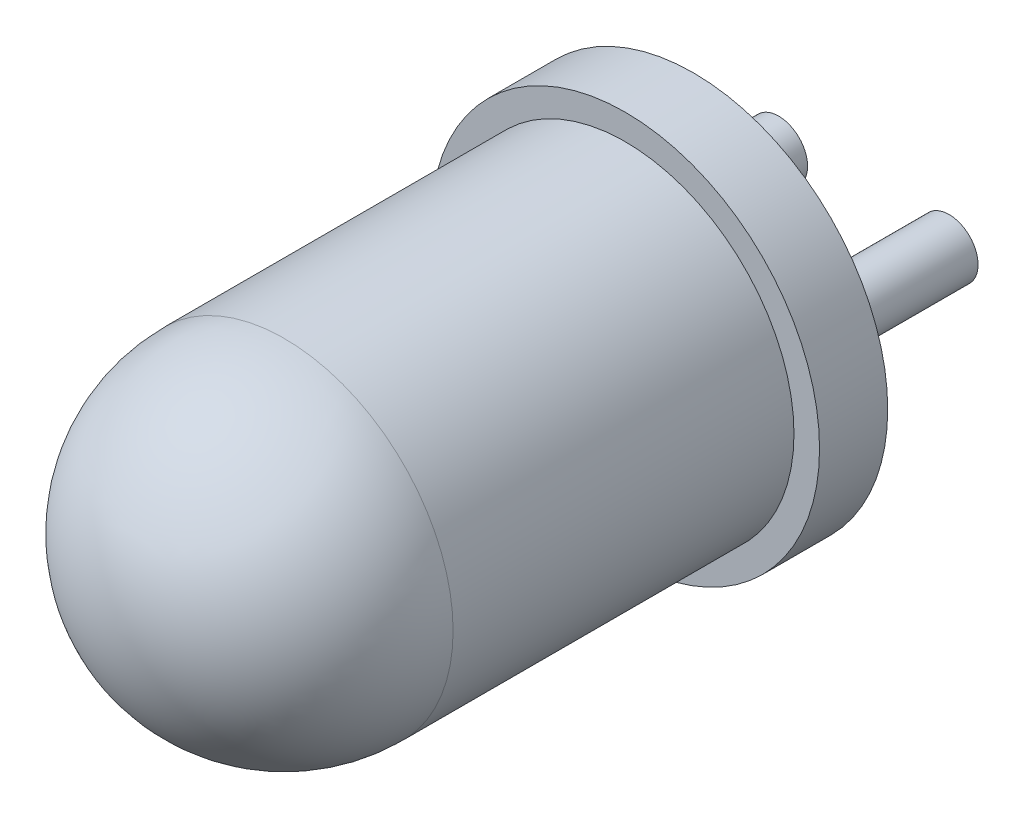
SolidWorks part; units mm, degrees
ref_plane "Спереди" through (0, 0, 0) normal (0, 0, 1) x (1, 0, 0)
ref_plane "Сверху" through (0, 0, 0) normal (0, 1, 0) x (1, 0, 0)
ref_plane "Справа" through (0, 0, 0) normal (1, 0, 0) x (0, 0, -1)
sketch "Эскиз1" plane through (0, 0, 0) normal (0, 0, 1) x (1, 0, 0)
  circle A0 centre (0, 0) radius 2.8956
extrude "Бобышка-Вытянуть1" add sketch "Эскиз1" along normal blind 1.016
sketch "Эскиз2" plane through (0, 0, 1.016) normal (0, 0, 1) x (1, 0, 0)
  circle A0 centre (0, 0) radius 2.5146
extrude "Бобышка-Вытянуть2" add sketch "Эскиз2" along normal blind 5.08
dome "Купол2" faces to dome 2 distance 2.5146 parameters "D1"=2.5146
sketch "Sketch1" plane through (0, 0, 0) normal (0, 0, -1) x (-1, 0, 0)
  circle A0 centre (1.27, 0) radius 0.4318
  circle A1 centre (-1.27, 0) radius 0.4318
extrude "Boss-Extrude1" add sketch "Sketch1" along normal blind 2.54 separate body
